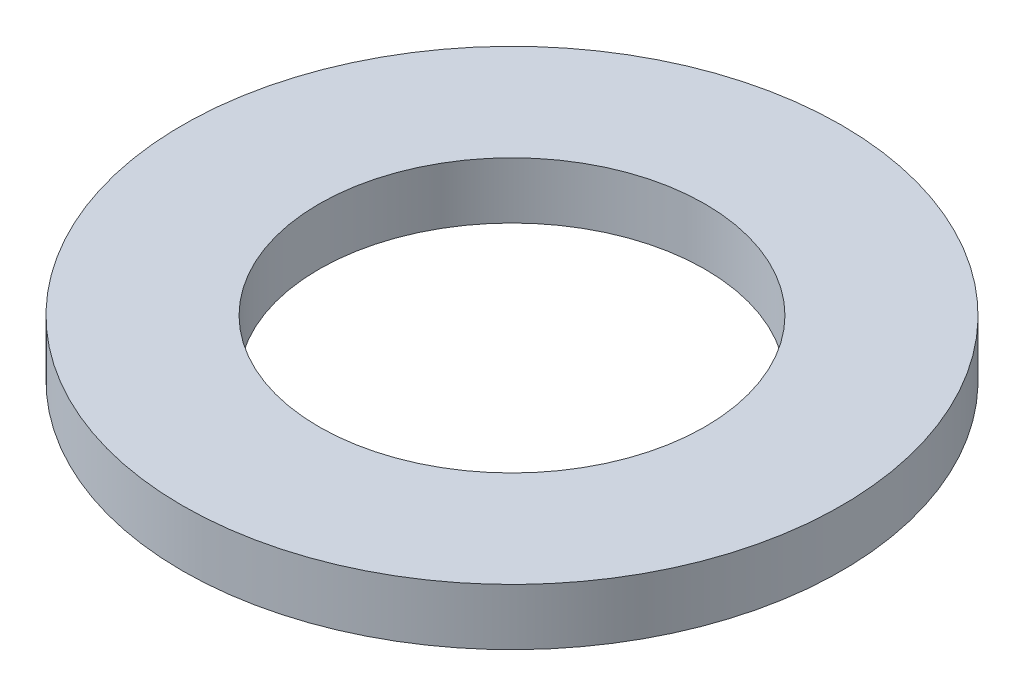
SolidWorks part; units mm, degrees
ref_plane "Front" through (0, 0, 0) normal (0, 0, 1) x (1, 0, 0)
ref_plane "Top" through (0, 0, 0) normal (0, 1, 0) x (1, 0, 0)
ref_plane "Right" through (0, 0, 0) normal (1, 0, 0) x (0, 0, -1)
sketch "Sketch1" plane through (0, 0, 0) normal (0, 1, 0) x (1, 0, 0)
  circle A0 centre (0, 0) radius 41
  circle A1 centre (0, 0) radius 70
extrude "Extrude1" add sketch "Sketch1" along normal blind 12
